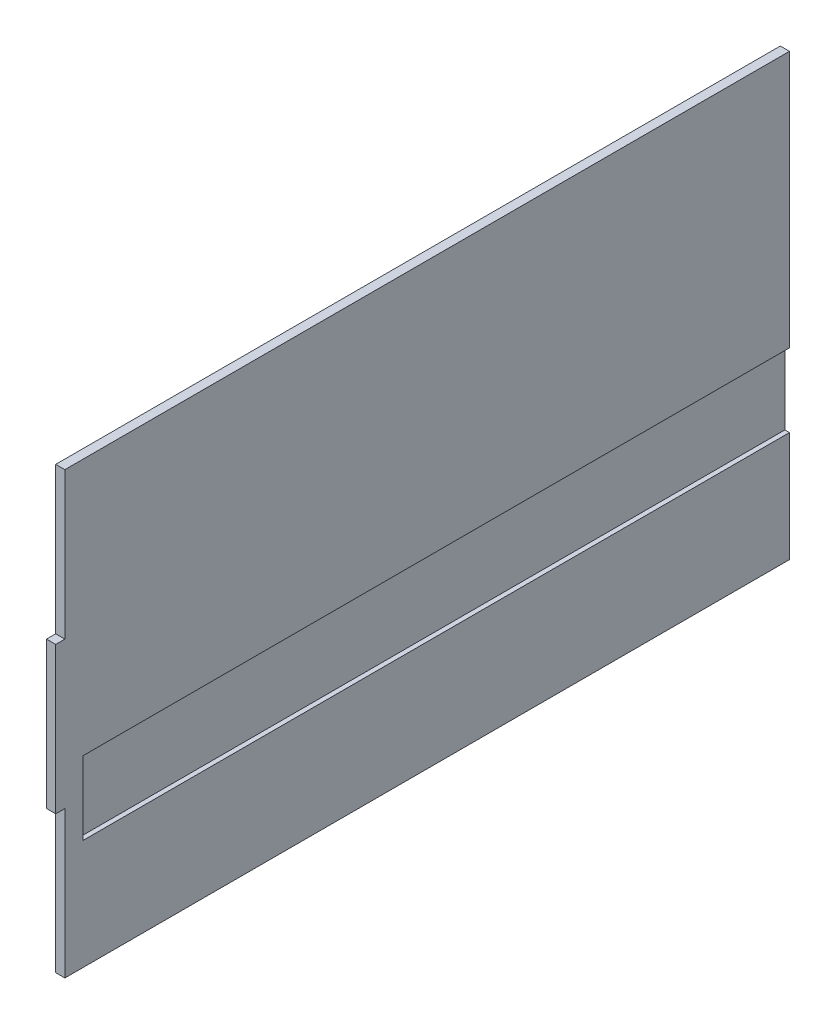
SolidWorks part; units mm, degrees
ref_plane "Front Plane" through (0, 0, 0) normal (0, 0, 1) x (1, 0, 0)
ref_plane "Top Plane" through (0, 0, 0) normal (0, 1, 0) x (1, 0, 0)
ref_plane "Right Plane" through (0, 0, 0) normal (1, 0, 0) x (0, 0, -1)
sketch "Sketch1" plane through (0, 0, 0) normal (0, 1, 0) x (1, 0, 0)
  line L1 (-1.5875, 127) -> (1.5875, 127)
  line L2 (-1.5875, 127) -> (-1.5875, -127)
  line L3 (-1.5875, -127) -> (1.5875, -127)
  line L4 (1.5875, 127) -> (1.5875, -127)
  line L5 (-1.5875, 127) -> (1.5875, -127) construction
  line L6 (-1.5875, -127) -> (1.5875, 127) construction
  point P0 (0, 0)
extrude "Boss-Extrude1" add sketch "Sketch1" along normal blind 152.4
sketch "Sketch2" plane through (-1.5875, 0, 0) normal (-1, 0, 0) x (0, 0, 1)
  line L0 (-127, 50.8) -> (127, 50.8) construction
  line L1 (-127, 152.4) -> (-127, 0) construction
  line L2 (127, 152.4) -> (127, 0) construction
  line L3 (-127, 0) -> (127, 0) construction
  line L4 (-127, 63.5) -> (95.5103, 38.1) construction
  line L5 (-127, 63.5) -> (107, 63.5)
  line L6 (-127, 63.5) -> (-127, 38.1)
  line L7 (-127, 38.1) -> (107, 38.1)
  line L8 (107, 63.5) -> (107, 38.1)
  point P8 (0, 50.8)
  point P13 (-127, 50.8)
extrude "Cut-Extrude1" [suppressed] cut sketch "Sketch2" against normal blind 2
sketch "Sketch3" plane through (-1.5875, 0, 0) normal (-1, 0, 0) x (0, 0, 1)
  line L0 (127, 76.2) -> (157.2308, 76.2) construction
  line L1 (127, 152.4) -> (127, 0) construction
  line L7 (127, 50.8) -> (123.825, 50.8)
  line L8 (127, 152.4) -> (123.825, 152.4)
  line L9 (127, 152.4) -> (127, 101.6)
  line L10 (127, 101.6) -> (123.825, 101.6)
  line L11 (123.825, 152.4) -> (123.825, 101.6)
  line L12 (123.825, 0) -> (123.825, 50.8)
  line L13 (127, 0) -> (123.825, 0)
  line L14 (127, 0) -> (127, 50.8)
extrude "Cut-Extrude2" cut sketch "Sketch3" against normal through all
sketch "Sketch4" plane through (1.5875, 0, 0) normal (1, 0, 0) x (0, 0, -1)
  line L0 (127, 50.8) -> (-135.8165, 50.8) construction
  line L1 (127, 152.4) -> (127, 0) construction
  line L2 (-123.825, 0) -> (127, 0) construction
  line L4 (127, 63.5) -> (-117.475, 63.5)
  line L5 (127, 63.5) -> (127, 38.1)
  line L6 (127, 38.1) -> (-117.475, 38.1)
  line L7 (-117.475, 63.5) -> (-117.475, 38.1)
  point P12 (127, 50.8)
extrude "Cut-Extrude3" cut sketch "Sketch4" against normal blind 1.5875
equation "\"RackHeight\" = 2.0in"
equation "\"D1@Sketch2\"=\"RackHeight\""
equation "\"RackThickness\" = 1.0in"
equation "\"D2@Sketch2\"=\"RackThickness\""
equation "\"RackCapLength\" = 20mm"
equation "\"D3@Sketch2\"=\"RackCapLength\""
equation "\"WallThickness\" = 0.125in"
equation "\"WallHeight\" = 6in"
equation "\"D1@Boss-Extrude1\"=\"WallHeight\""
equation "\"D2@Sketch1\"=\"WallThickness\""
equation "\"D1@Sketch1\"= \"SideLength\""
equation "\"D1@Sketch3\"=\"WallThickness\""
equation "\"D2@Sketch3\"=\"WallHeight\"/3"
equation "\"SideLength\" = 10in"
equation "\"BackLength\" = 11.25in"
equation "\"D1@Sketch4\"=\"RackHeight\""
equation "\"D3@Sketch4\"=\"RackThickness\""
equation "\"D1@Cut-Extrude3\"=\"WallThickness\"/2"
equation "\"RackLength\" = 9.5in"
equation "\"HoleDiameter\" = 4.3688mm"
equation "\"D2@Sketch4\"=\"RackLength\"+0.125in"
